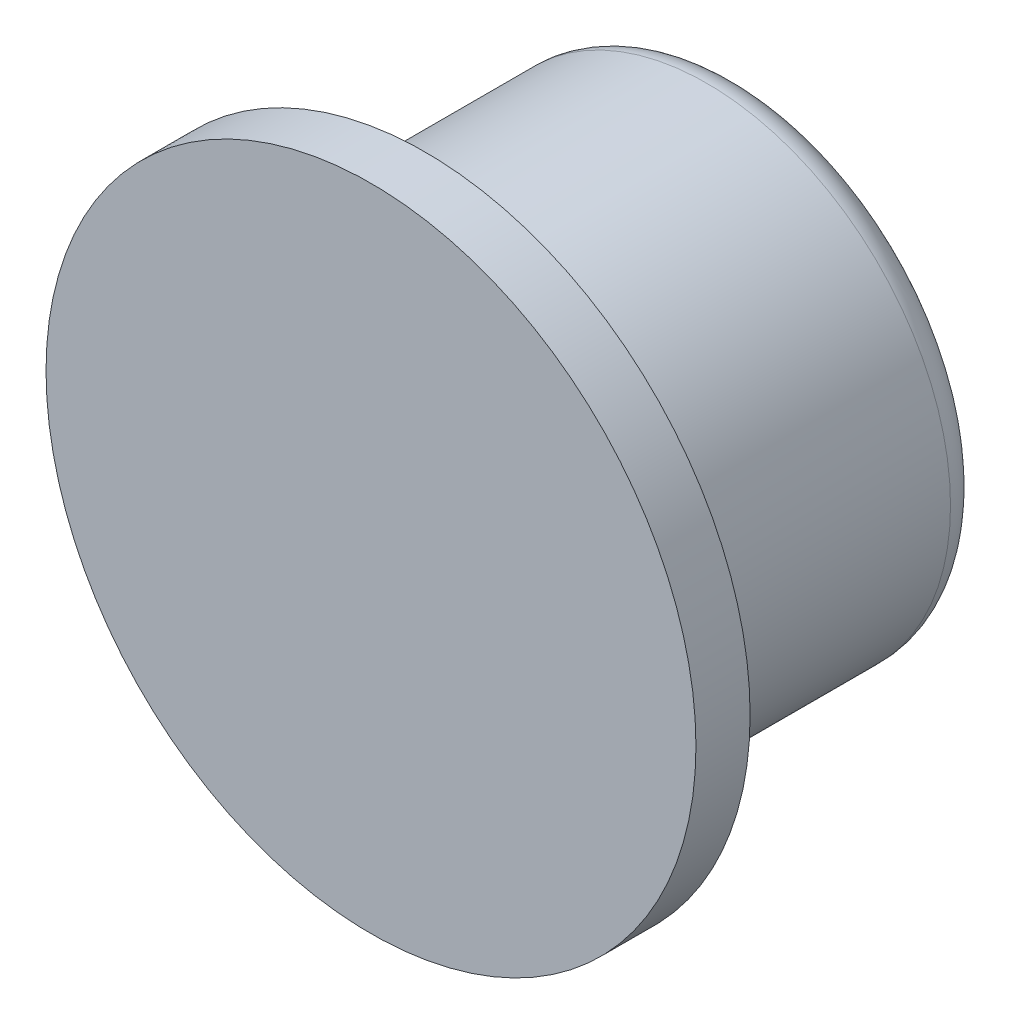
SolidWorks part; units mm, degrees
ref_plane "Front Plane" through (0, 0, 0) normal (0, 0, 1) x (1, 0, 0)
ref_plane "Top Plane" through (0, 0, 0) normal (0, 1, 0) x (1, 0, 0)
ref_plane "Right Plane" through (0, 0, 0) normal (1, 0, 0) x (0, 0, -1)
sketch "Sketch1" plane through (0, 0, 0) normal (1, 0, 0) x (0, 0, -1)
  line L0 (0, 0) -> (0, 30)
  line L1 (0, 30) -> (5, 30)
  line L2 (5, 30) -> (5, 22.5)
  line L3 (5, 22.5) -> (31, 22.5)
  line L4 (34, 19.5) -> (34, 4.5)
  line L5 (22.6906, 0) -> (0, 0)
  line L6 (33.5, 4) -> (25, 4)
  line L7 (33.5, 4) -> (34, 4.5)
  line L8 (25, 4) -> (22.6906, 0)
  arc A0 (31, 22.5) -> (34, 19.5) centre (31, 19.5) cw
  dimension "D2" = 3
  dimension "D1" = 30
  dimension "D3" = 5
  dimension "D4" = 29
  dimension "D5" = 22.5
  dimension "D6" = 4
  dimension "D7" = 0.5
  dimension "D8" = 45
  dimension "D9" = 60
  dimension "D10" = 9
revolve "Revolve1" add sketch "Sketch1" angle 360 about L5
